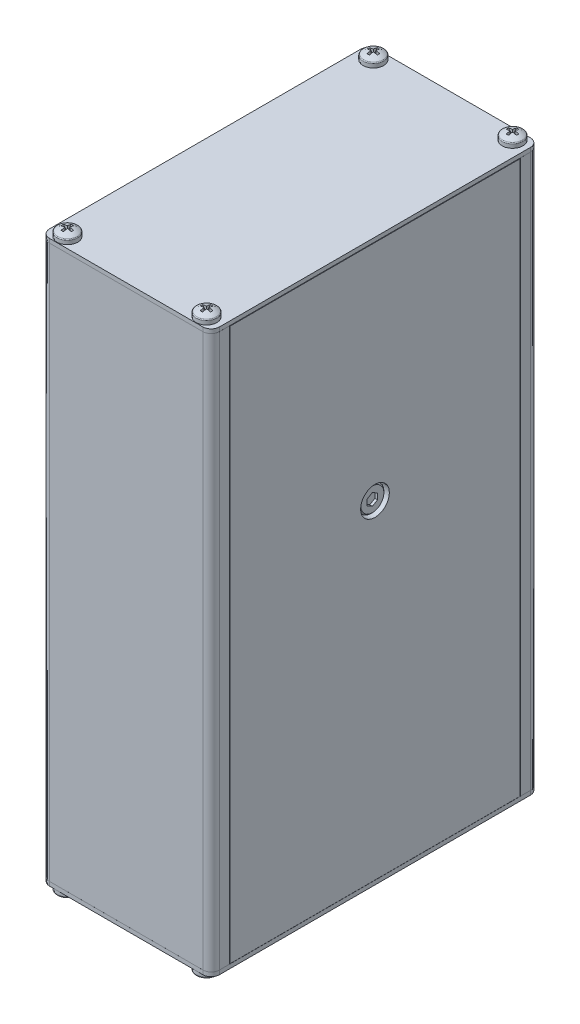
SolidWorks part; units mm, degrees
ref_plane "Front Plane" through (0, 0, 0) normal (0, 0, 1) x (1, 0, 0)
ref_plane "Top Plane" through (0, 0, 0) normal (0, 1, 0) x (1, 0, 0)
ref_plane "Right Plane" through (0, 0, 0) normal (1, 0, 0) x (0, 0, -1)
imported_body "Imported1"
imported_body "Imported2"
imported_body "Imported3"
sketch "Sketch1" plane through (28.575, 0, 0) normal (-1, 0, 0) x (0, 0, 1)
  line L0 (60.3308, -52.9209) -> (63.5058, -52.9209) construction
  line L1 (-63.5, 48.1838) -> (63.5, 48.1838)
  line L2 (-63.5, 48.1838) -> (-63.5, -52.9209)
  line L3 (-63.5, -52.9209) -> (63.5, -52.9209)
  line L4 (63.5, 48.1838) -> (63.5, -52.9209)
  line L5 (-63.5, 163.0121) -> (-63.5, -51.3334) construction
  line L6 (63.5, 163.0121) -> (63.5, -51.3334) construction
  line L8 (31.623, 41.8338) -> (-31.623, 41.8338) construction
  dimension "D1" = 6.35
extrude "Cut-Extrude1" cut sketch "Sketch1" along normal blind 0.3334
delete or keep bodies "Body-Delete/Keep 1" type keep bodies bodies 105 102 103 106
